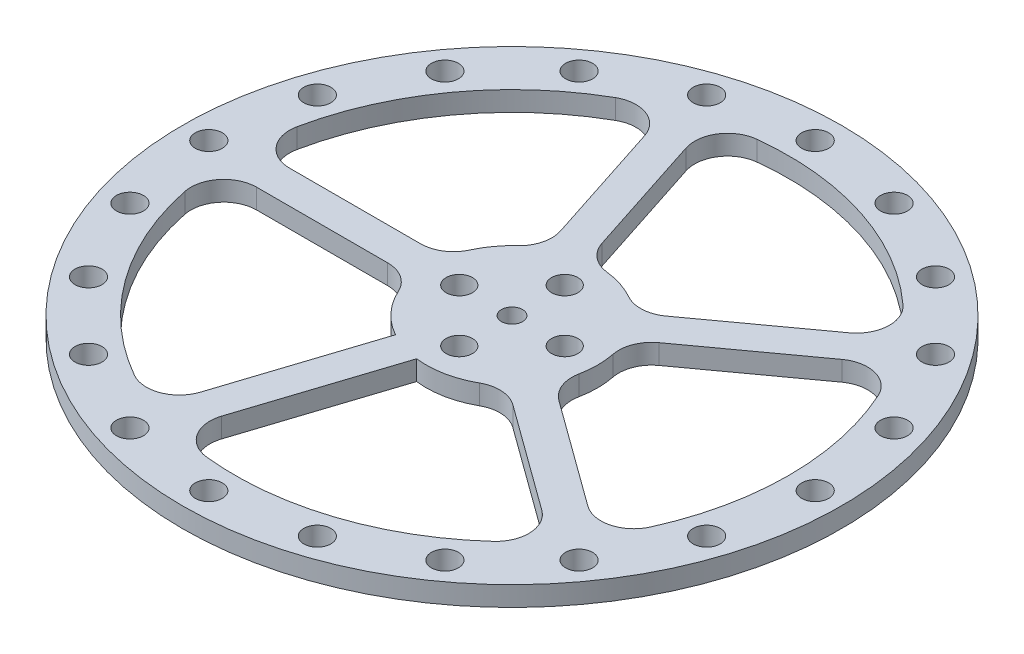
SolidWorks part; units mm, degrees
other "Camera1"
ref_plane "Front Plane" through (0, 0, 0) normal (0, 0, 1) x (1, 0, 0)
ref_plane "Top Plane" through (0, 0, 0) normal (0, 1, 0) x (1, 0, 0)
ref_plane "Right Plane" through (0, 0, 0) normal (1, 0, 0) x (0, 0, -1)
sketch "Sketch1" plane through (0, 0, 0) normal (0, 1, 0) x (1, 0, 0)
  circle A0 centre (0, 0) radius 50
  dimension "D1" = 100
extrude "Boss-Extrude1" add sketch "Sketch1" along normal blind 3 contours A0
sketch "Sketch2" plane through (0, 3, 0) normal (0, 1, 0) x (1, 0, 0)
  circle A0 centre (0, 0) radius 1.6
  dimension "D1" = 3.2
extrude "Cut-Extrude1" cut sketch "Sketch2" against normal through all both and the other way through all
sketch "Sketch4" plane through (0, 3, 0) normal (0, 1, 0) x (1, 0, 0)
  line L0 (-10.5781, 40.6461) -> (-1.5646, 12.9055)
  line L1 (-41.9255, 2.5) -> (-12.7574, 2.5)
  line L2 (-41.9255, -2.5) -> (-12.7574, -2.5)
  line L3 (-15.3333, 39.101) -> (-6.3199, 11.3604)
  line L4 (35.3879, 22.6207) -> (11.7904, 5.476)
  line L5 (32.449, 26.6658) -> (8.8515, 9.5211)
  line L6 (-50, 0) -> (-42, 0)
  line L7 (32.449, -26.6658) -> (8.8515, -9.5211)
  line L8 (35.3879, -22.6207) -> (11.7904, -5.476)
  line L9 (0, 0) -> (-42, 0) construction
  line L10 (-15.3333, -39.101) -> (-6.3199, -11.3604)
  line L11 (-10.5781, -40.6461) -> (-1.5646, -12.9055)
  circle A0 centre (0, 0) radius 42
  circle A1 centre (0, 0) radius 13
  circle A4 centre (0, 0) radius 50 construction
  point P7 (-42, 0)
  point P23 (0.4351, 0.3723)
  point P29 (0, 0)
  dimension "D1" = 5
  dimension "D2" = 26
  dimension "D3" = 8
  dimension "D4" = 5
extrude "Cut-Extrude2" cut sketch "Sketch4" along normal through all and the other way through all contours A1 L2 A0 L10 | A1 L3 A0 L1 | A1 L5 A0 L0 | A1 L8 A0 L4 | A1 L11 A0 L7
ref_plane "Plane1" through (0, 1.5, 0) normal (0, 1, 0) x (1, 0, 0)
fillet "Fillet1" radius 5 10 edges at (-41.9255, 1.5, 2.5) (32.449, 1.5, 26.6658) (35.3879, 1.5, 22.6207) (35.3879, 1.5, -22.6207) (32.449, 1.5, -26.6658) (-10.5781, 1.5, -40.6461) (-15.3333, 1.5, -39.101) (-41.9255, 1.5, -2.5) (-10.5781, 1.5, 40.6461) (-15.3333, 1.5, 39.101)
fillet "Fillet2" radius 5 8 edges at (8.8515, 1.5, 9.5211) (-12.7574, 1.5, 2.5) (11.7904, 1.5, 5.476) (11.7904, 1.5, -5.476) (8.8515, 1.5, -9.5211) (-1.5646, 1.5, -12.9055) (-12.7574, 1.5, -2.5) (-6.3199, 1.5, -11.3604)
sketch "Sketch5" plane through (0, 3, 0) normal (0, 1, 0) x (1, 0, 0)
  line L0 (0, 42) -> (0, 50) construction
  circle A0 centre (0, 0) radius 42 construction
  circle A1 centre (0, 0) radius 50 construction
  circle A2 centre (0, 46) radius 2.05
  dimension "D1" = 4.1
extrude "Cut-Extrude3" cut sketch "Sketch5" against normal through all contours A2
pattern_circular "CirPattern1" count 20 over 360 about axis through (0, 0, 0) along (0, 1, 0) of "Cut-Extrude3"
sketch "Sketch6" plane through (0, 3, 0) normal (0, 1, 0) x (1, 0, 0)
  circle A0 centre (0, 0) radius 8 construction
  circle A1 centre (0, 8) radius 2
  dimension "D1" = 4
  dimension "D2" = 16
extrude "Cut-Extrude4" cut sketch "Sketch6" against normal through all contours A1
pattern_circular "CirPattern2" count 4 over 360 about axis through (0, 0, 0) along (0, 1, 0) of "Cut-Extrude4"
